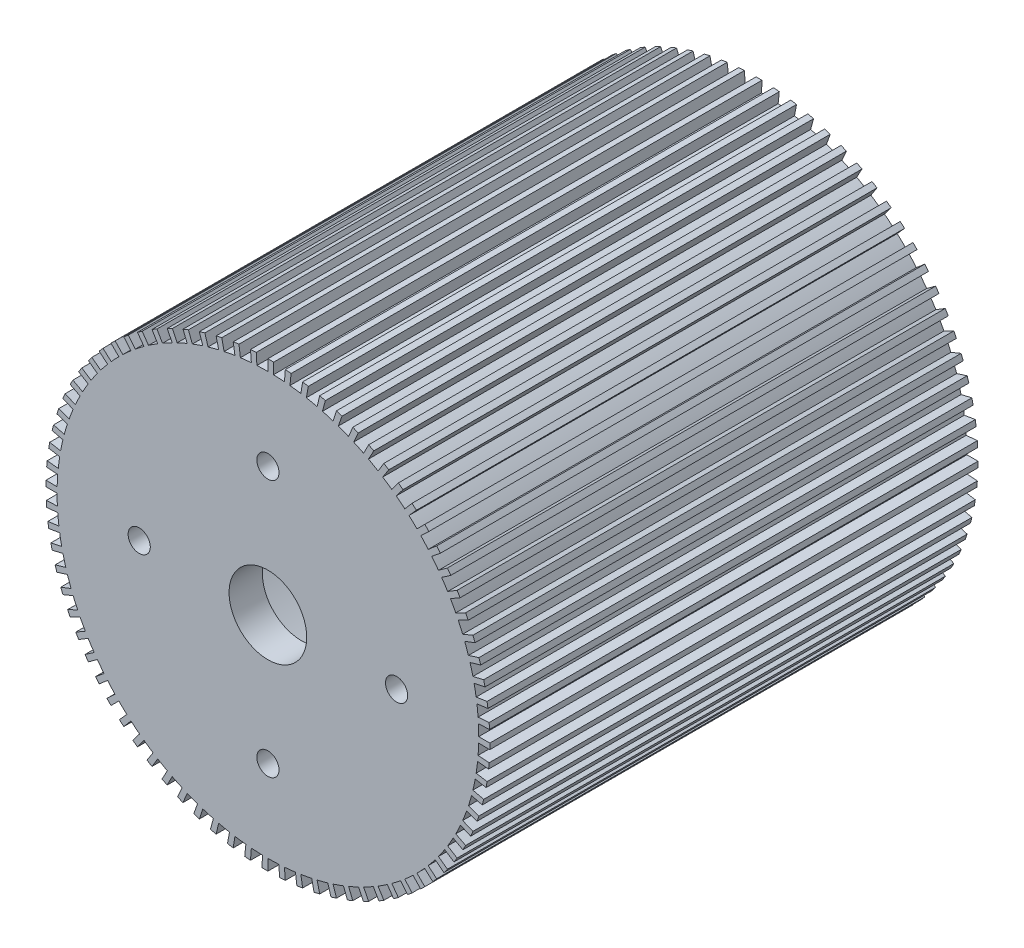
SolidWorks part; units mm, degrees
ref_plane "Alzado" through (0, 0, 0) normal (0, 0, 1) x (1, 0, 0)
ref_plane "Planta" through (0, 0, 0) normal (0, 1, 0) x (1, 0, 0)
ref_plane "Vista lateral" through (0, 0, 0) normal (1, 0, 0) x (0, 0, -1)
sketch "Croquis1" plane through (0, 0, 0) normal (0, 0, 1) x (1, 0, 0)
  circle A0 centre (0, 0) radius 100
  dimension "D1" = 200
extrude "Saliente-Extruir1" add sketch "Croquis1" along normal blind 220
sketch "Croquis3" plane through (0, 0, 0) normal (1, 0, 0) x (0, 0, -1)
  line L0 (0, 0) -> (23.7635, 0) construction
sketch "Croquis4" plane through (0, 0, 0) normal (0, 0, -1) x (-1, 0, 0)
  line L0 (0, 95) -> (0, 100)
  line L1 (4.9719, 94.8698) -> (5.2336, 99.863)
  line L2 (7.4536, 94.7071) -> (7.8459, 99.6917)
  line L3 (12.4, 94.1873) -> (13.0526, 99.1445)
  line L4 (14.8613, 93.8304) -> (15.6434, 98.7688)
  line L5 (19.7516, 92.924) -> (20.7912, 97.8148)
  line L6 (22.1773, 92.3751) -> (23.3445, 97.237)
  line L7 (26.9815, 91.0879) -> (28.4015, 95.882)
  line L8 (29.3566, 90.3504) -> (30.9017, 95.1057)
  line L9 (34.045, 88.6901) -> (35.8368, 93.358)
  line L10 (36.3549, 87.7686) -> (38.2683, 92.388)
  line L11 (40.8986, 85.7456) -> (43.0511, 90.2585)
  line L12 (43.1291, 84.6456) -> (45.399, 89.1007)
  line L13 (47.5, 82.2724) -> (50, 86.6025)
  line L14 (49.6374, 81.0008) -> (52.2499, 85.264)
  line L15 (53.8086, 78.292) -> (56.6406, 82.4126)
  line L16 (55.8396, 76.8566) -> (58.7785, 80.9017)
  line L17 (59.7854, 73.8289) -> (62.932, 77.7146)
  line L18 (61.6976, 72.2386) -> (64.9448, 76.0406)
  line L19 (65.3937, 68.9106) -> (68.8355, 72.5374)
  line L20 (67.1751, 67.1751) -> (70.7107, 70.7107)
  line L21 (70.5988, 63.5674) -> (74.3145, 66.9131)
  line L22 (72.2386, 61.6976) -> (76.0406, 64.9448)
  line L23 (75.3686, 57.8323) -> (79.3353, 60.8761)
  line L24 (76.8566, 55.8396) -> (80.9017, 58.7785)
  line L25 (79.6737, 51.7407) -> (83.8671, 54.4639)
  line L26 (81.0008, 49.6374) -> (85.264, 52.2499)
  line L27 (83.4876, 45.3301) -> (87.8817, 47.7159)
  line L28 (84.6456, 43.1291) -> (89.1007, 45.399)
  line L29 (86.7868, 38.64) -> (91.3545, 40.6737)
  line L30 (87.7686, 36.3549) -> (92.388, 38.2683)
  line L31 (89.5509, 31.7117) -> (94.2641, 33.3807)
  line L32 (90.3504, 29.3566) -> (95.1057, 30.9017)
  line L33 (91.763, 24.5878) -> (96.5926, 25.8819)
  line L34 (92.3751, 22.1773) -> (97.237, 23.3445)
  line L35 (93.4092, 17.3124) -> (98.3255, 18.2236)
  line L36 (93.8304, 14.8613) -> (98.7688, 15.6434)
  line L37 (94.4796, 9.9302) -> (99.4522, 10.4528)
  line L38 (94.7071, 7.4536) -> (99.6917, 7.8459)
  line L39 (94.9674, 2.4868) -> (99.9657, 2.6177)
  line L40 (95, 0) -> (100, 0)
  line L41 (94.8698, -4.9719) -> (99.863, -5.2336)
  line L42 (94.7071, -7.4536) -> (99.6917, -7.8459)
  line L43 (94.1873, -12.4) -> (99.1445, -13.0526)
  line L44 (93.8304, -14.8613) -> (98.7688, -15.6434)
  line L45 (92.924, -19.7516) -> (97.8148, -20.7912)
  line L46 (92.3751, -22.1773) -> (97.237, -23.3445)
  line L47 (91.0879, -26.9815) -> (95.882, -28.4015)
  line L48 (90.3504, -29.3566) -> (95.1057, -30.9017)
  line L49 (88.6901, -34.045) -> (93.358, -35.8368)
  line L50 (87.7686, -36.3549) -> (92.388, -38.2683)
  line L51 (85.7456, -40.8986) -> (90.2585, -43.0511)
  line L52 (84.6456, -43.1291) -> (89.1007, -45.399)
  line L53 (82.2724, -47.5) -> (86.6025, -50)
  line L54 (81.0008, -49.6374) -> (85.264, -52.2499)
  line L55 (78.292, -53.8086) -> (82.4126, -56.6406)
  line L56 (76.8566, -55.8396) -> (80.9017, -58.7785)
  line L57 (73.8289, -59.7854) -> (77.7146, -62.932)
  line L58 (72.2386, -61.6976) -> (76.0406, -64.9448)
  line L59 (68.9106, -65.3937) -> (72.5374, -68.8355)
  line L60 (67.1751, -67.1751) -> (70.7107, -70.7107)
  line L61 (63.5674, -70.5988) -> (66.9131, -74.3145)
  line L62 (61.6976, -72.2386) -> (64.9448, -76.0406)
  line L63 (57.8323, -75.3686) -> (60.8761, -79.3353)
  line L64 (55.8396, -76.8566) -> (58.7785, -80.9017)
  line L65 (51.7407, -79.6737) -> (54.4639, -83.8671)
  line L66 (49.6374, -81.0008) -> (52.2499, -85.264)
  line L67 (45.3301, -83.4876) -> (47.7159, -87.8817)
  line L68 (43.1291, -84.6456) -> (45.399, -89.1007)
  line L69 (38.64, -86.7868) -> (40.6737, -91.3545)
  line L70 (36.3549, -87.7686) -> (38.2683, -92.388)
  line L71 (31.7117, -89.5509) -> (33.3807, -94.2641)
  line L72 (29.3566, -90.3504) -> (30.9017, -95.1057)
  line L73 (24.5878, -91.763) -> (25.8819, -96.5926)
  line L74 (22.1773, -92.3751) -> (23.3445, -97.237)
  line L75 (17.3124, -93.4092) -> (18.2236, -98.3255)
  line L76 (14.8613, -93.8304) -> (15.6434, -98.7688)
  line L77 (9.9302, -94.4796) -> (10.4528, -99.4522)
  line L78 (7.4536, -94.7071) -> (7.8459, -99.6917)
  line L79 (2.4868, -94.9674) -> (2.6177, -99.9657)
  line L80 (0, -95) -> (0, -100)
  line L81 (-4.9719, -94.8698) -> (-5.2336, -99.863)
  line L82 (-7.4536, -94.7071) -> (-7.8459, -99.6917)
  line L83 (-12.4, -94.1873) -> (-13.0526, -99.1445)
  line L84 (-14.8613, -93.8304) -> (-15.6434, -98.7688)
  line L85 (-19.7516, -92.924) -> (-20.7912, -97.8148)
  line L86 (-22.1773, -92.3751) -> (-23.3445, -97.237)
  line L87 (-26.9815, -91.0879) -> (-28.4015, -95.882)
  line L88 (-29.3566, -90.3504) -> (-30.9017, -95.1057)
  line L89 (-34.045, -88.6901) -> (-35.8368, -93.358)
  line L90 (-36.3549, -87.7686) -> (-38.2683, -92.388)
  line L91 (-40.8986, -85.7456) -> (-43.0511, -90.2585)
  line L92 (-43.1291, -84.6456) -> (-45.399, -89.1007)
  line L93 (-47.5, -82.2724) -> (-50, -86.6025)
  line L94 (-49.6374, -81.0008) -> (-52.2499, -85.264)
  line L95 (-53.8086, -78.292) -> (-56.6406, -82.4126)
  line L96 (-55.8396, -76.8566) -> (-58.7785, -80.9017)
  line L97 (-59.7854, -73.8289) -> (-62.932, -77.7146)
  line L98 (-61.6976, -72.2386) -> (-64.9448, -76.0406)
  line L99 (-65.3937, -68.9106) -> (-68.8355, -72.5374)
  line L100 (-67.1751, -67.1751) -> (-70.7107, -70.7107)
  line L101 (-70.5988, -63.5674) -> (-74.3145, -66.9131)
  line L102 (-72.2386, -61.6976) -> (-76.0406, -64.9448)
  line L103 (-75.3686, -57.8323) -> (-79.3353, -60.8761)
  line L104 (-76.8566, -55.8396) -> (-80.9017, -58.7785)
  line L105 (-79.6737, -51.7407) -> (-83.8671, -54.4639)
  line L106 (-81.0008, -49.6374) -> (-85.264, -52.2499)
  line L107 (-83.4876, -45.3301) -> (-87.8817, -47.7159)
  line L108 (-84.6456, -43.1291) -> (-89.1007, -45.399)
  line L109 (-86.7868, -38.64) -> (-91.3545, -40.6737)
  line L110 (-87.7686, -36.3549) -> (-92.388, -38.2683)
  line L111 (-89.5509, -31.7117) -> (-94.2641, -33.3807)
  line L112 (-90.3504, -29.3566) -> (-95.1057, -30.9017)
  line L113 (-91.763, -24.5878) -> (-96.5926, -25.8819)
  line L114 (-92.3751, -22.1773) -> (-97.237, -23.3445)
  line L115 (-93.4092, -17.3124) -> (-98.3255, -18.2236)
  line L116 (-93.8304, -14.8613) -> (-98.7688, -15.6434)
  line L117 (-94.4796, -9.9302) -> (-99.4522, -10.4528)
  line L118 (-94.7071, -7.4536) -> (-99.6917, -7.8459)
  line L119 (-94.9674, -2.4868) -> (-99.9657, -2.6177)
  line L120 (-95, 0) -> (-100, 0)
  line L121 (-94.8698, 4.9719) -> (-99.863, 5.2336)
  line L122 (-94.7071, 7.4536) -> (-99.6917, 7.8459)
  line L123 (-94.1873, 12.4) -> (-99.1445, 13.0526)
  line L124 (-93.8304, 14.8613) -> (-98.7688, 15.6434)
  line L125 (-92.924, 19.7516) -> (-97.8148, 20.7912)
  line L126 (-92.3751, 22.1773) -> (-97.237, 23.3445)
  line L127 (-91.0879, 26.9815) -> (-95.882, 28.4015)
  line L128 (-90.3504, 29.3566) -> (-95.1057, 30.9017)
  line L129 (-88.6901, 34.045) -> (-93.358, 35.8368)
  line L130 (-87.7686, 36.3549) -> (-92.388, 38.2683)
  line L131 (-85.7456, 40.8986) -> (-90.2585, 43.0511)
  line L132 (-84.6456, 43.1291) -> (-89.1007, 45.399)
  line L133 (-82.2724, 47.5) -> (-86.6025, 50)
  line L134 (-81.0008, 49.6374) -> (-85.264, 52.2499)
  line L135 (-78.292, 53.8086) -> (-82.4126, 56.6406)
  line L136 (-76.8566, 55.8396) -> (-80.9017, 58.7785)
  line L137 (-73.8289, 59.7854) -> (-77.7146, 62.932)
  line L138 (-72.2386, 61.6976) -> (-76.0406, 64.9448)
  line L139 (-68.9106, 65.3937) -> (-72.5374, 68.8355)
  line L140 (-67.1751, 67.1751) -> (-70.7107, 70.7107)
  line L141 (-63.5674, 70.5988) -> (-66.9131, 74.3145)
  line L142 (-61.6976, 72.2386) -> (-64.9448, 76.0406)
  line L143 (-57.8323, 75.3686) -> (-60.8761, 79.3353)
  line L144 (-55.8396, 76.8566) -> (-58.7785, 80.9017)
  line L145 (-51.7407, 79.6737) -> (-54.4639, 83.8671)
  line L146 (-49.6374, 81.0008) -> (-52.2499, 85.264)
  line L147 (-45.3301, 83.4876) -> (-47.7159, 87.8817)
  line L148 (-43.1291, 84.6456) -> (-45.399, 89.1007)
  line L149 (-38.64, 86.7868) -> (-40.6737, 91.3545)
  line L150 (-36.3549, 87.7686) -> (-38.2683, 92.388)
  line L151 (-31.7117, 89.5509) -> (-33.3807, 94.2641)
  line L152 (-29.3566, 90.3504) -> (-30.9017, 95.1057)
  line L153 (-24.5878, 91.763) -> (-25.8819, 96.5926)
  line L154 (-22.1773, 92.3751) -> (-23.3445, 97.237)
  line L155 (-17.3124, 93.4092) -> (-18.2236, 98.3255)
  line L156 (-14.8613, 93.8304) -> (-15.6434, 98.7688)
  line L157 (-9.9302, 94.4796) -> (-10.4528, 99.4522)
  line L158 (-7.4536, 94.7071) -> (-7.8459, 99.6917)
  line L159 (-2.4868, 94.9674) -> (-2.6177, 99.9657)
  arc A0 (5.2336, 99.863) -> (0, 100) centre (0, 0) ccw
  arc A1 (4.9719, 94.8698) -> (0, 95) centre (0, 0) ccw
  arc A2 (12.4, 94.1873) -> (7.4536, 94.7071) centre (0, 0) ccw
  arc A3 (13.0526, 99.1445) -> (7.8459, 99.6917) centre (0, 0) ccw
  arc A4 (19.7516, 92.924) -> (14.8613, 93.8304) centre (0, 0) ccw
  arc A5 (20.7912, 97.8148) -> (15.6434, 98.7688) centre (0, 0) ccw
  arc A6 (26.9815, 91.0879) -> (22.1773, 92.3751) centre (0, 0) ccw
  arc A7 (28.4015, 95.882) -> (23.3445, 97.237) centre (0, 0) ccw
  arc A8 (34.045, 88.6901) -> (29.3566, 90.3504) centre (0, 0) ccw
  arc A9 (35.8368, 93.358) -> (30.9017, 95.1057) centre (0, 0) ccw
  arc A10 (40.8986, 85.7456) -> (36.3549, 87.7686) centre (0, 0) ccw
  arc A11 (43.0511, 90.2585) -> (38.2683, 92.388) centre (0, 0) ccw
  arc A12 (47.5, 82.2724) -> (43.1291, 84.6456) centre (0, 0) ccw
  arc A13 (50, 86.6025) -> (45.399, 89.1007) centre (0, 0) ccw
  arc A14 (53.8086, 78.292) -> (49.6374, 81.0008) centre (0, 0) ccw
  arc A15 (56.6406, 82.4126) -> (52.2499, 85.264) centre (0, 0) ccw
  arc A16 (59.7854, 73.8289) -> (55.8396, 76.8566) centre (0, 0) ccw
  arc A17 (62.932, 77.7146) -> (58.7785, 80.9017) centre (0, 0) ccw
  arc A18 (65.3937, 68.9106) -> (61.6976, 72.2386) centre (0, 0) ccw
  arc A19 (68.8355, 72.5374) -> (64.9448, 76.0406) centre (0, 0) ccw
  arc A20 (70.5988, 63.5674) -> (67.1751, 67.1751) centre (0, 0) ccw
  arc A21 (74.3145, 66.9131) -> (70.7107, 70.7107) centre (0, 0) ccw
  arc A22 (75.3686, 57.8323) -> (72.2386, 61.6976) centre (0, 0) ccw
  arc A23 (79.3353, 60.8761) -> (76.0406, 64.9448) centre (0, 0) ccw
  arc A24 (79.6737, 51.7407) -> (76.8566, 55.8396) centre (0, 0) ccw
  arc A25 (83.8671, 54.4639) -> (80.9017, 58.7785) centre (0, 0) ccw
  arc A26 (83.4876, 45.3301) -> (81.0008, 49.6374) centre (0, 0) ccw
  arc A27 (87.8817, 47.7159) -> (85.264, 52.2499) centre (0, 0) ccw
  arc A28 (86.7868, 38.64) -> (84.6456, 43.1291) centre (0, 0) ccw
  arc A29 (91.3545, 40.6737) -> (89.1007, 45.399) centre (0, 0) ccw
  arc A30 (89.5509, 31.7117) -> (87.7686, 36.3549) centre (0, 0) ccw
  arc A31 (94.2641, 33.3807) -> (92.388, 38.2683) centre (0, 0) ccw
  arc A32 (91.763, 24.5878) -> (90.3504, 29.3566) centre (0, 0) ccw
  arc A33 (96.5926, 25.8819) -> (95.1057, 30.9017) centre (0, 0) ccw
  arc A34 (93.4092, 17.3124) -> (92.3751, 22.1773) centre (0, 0) ccw
  arc A35 (98.3255, 18.2236) -> (97.237, 23.3445) centre (0, 0) ccw
  arc A36 (94.4796, 9.9302) -> (93.8304, 14.8613) centre (0, 0) ccw
  arc A37 (99.4522, 10.4528) -> (98.7688, 15.6434) centre (0, 0) ccw
  arc A38 (94.9674, 2.4868) -> (94.7071, 7.4536) centre (0, 0) ccw
  arc A39 (99.9657, 2.6177) -> (99.6917, 7.8459) centre (0, 0) ccw
  arc A40 (94.8698, -4.9719) -> (95, 0) centre (0, 0) ccw
  arc A41 (99.863, -5.2336) -> (100, 0) centre (0, 0) ccw
  arc A42 (94.1873, -12.4) -> (94.7071, -7.4536) centre (0, 0) ccw
  arc A43 (99.1445, -13.0526) -> (99.6917, -7.8459) centre (0, 0) ccw
  arc A44 (92.924, -19.7516) -> (93.8304, -14.8613) centre (0, 0) ccw
  arc A45 (97.8148, -20.7912) -> (98.7688, -15.6434) centre (0, 0) ccw
  arc A46 (91.0879, -26.9815) -> (92.3751, -22.1773) centre (0, 0) ccw
  arc A47 (95.882, -28.4015) -> (97.237, -23.3445) centre (0, 0) ccw
  arc A48 (88.6901, -34.045) -> (90.3504, -29.3566) centre (0, 0) ccw
  arc A49 (93.358, -35.8368) -> (95.1057, -30.9017) centre (0, 0) ccw
  arc A50 (85.7456, -40.8986) -> (87.7686, -36.3549) centre (0, 0) ccw
  arc A51 (90.2585, -43.0511) -> (92.388, -38.2683) centre (0, 0) ccw
  arc A52 (82.2724, -47.5) -> (84.6456, -43.1291) centre (0, 0) ccw
  arc A53 (86.6025, -50) -> (89.1007, -45.399) centre (0, 0) ccw
  arc A54 (78.292, -53.8086) -> (81.0008, -49.6374) centre (0, 0) ccw
  arc A55 (82.4126, -56.6406) -> (85.264, -52.2499) centre (0, 0) ccw
  arc A56 (73.8289, -59.7854) -> (76.8566, -55.8396) centre (0, 0) ccw
  arc A57 (77.7146, -62.932) -> (80.9017, -58.7785) centre (0, 0) ccw
  arc A58 (68.9106, -65.3937) -> (72.2386, -61.6976) centre (0, 0) ccw
  arc A59 (72.5374, -68.8355) -> (76.0406, -64.9448) centre (0, 0) ccw
  arc A60 (63.5674, -70.5988) -> (67.1751, -67.1751) centre (0, 0) ccw
  arc A61 (66.9131, -74.3145) -> (70.7107, -70.7107) centre (0, 0) ccw
  arc A62 (57.8323, -75.3686) -> (61.6976, -72.2386) centre (0, 0) ccw
  arc A63 (60.8761, -79.3353) -> (64.9448, -76.0406) centre (0, 0) ccw
  arc A64 (51.7407, -79.6737) -> (55.8396, -76.8566) centre (0, 0) ccw
  arc A65 (54.4639, -83.8671) -> (58.7785, -80.9017) centre (0, 0) ccw
  arc A66 (45.3301, -83.4876) -> (49.6374, -81.0008) centre (0, 0) ccw
  arc A67 (47.7159, -87.8817) -> (52.2499, -85.264) centre (0, 0) ccw
  arc A68 (38.64, -86.7868) -> (43.1291, -84.6456) centre (0, 0) ccw
  arc A69 (40.6737, -91.3545) -> (45.399, -89.1007) centre (0, 0) ccw
  arc A70 (31.7117, -89.5509) -> (36.3549, -87.7686) centre (0, 0) ccw
  arc A71 (33.3807, -94.2641) -> (38.2683, -92.388) centre (0, 0) ccw
  arc A72 (24.5878, -91.763) -> (29.3566, -90.3504) centre (0, 0) ccw
  arc A73 (25.8819, -96.5926) -> (30.9017, -95.1057) centre (0, 0) ccw
  arc A74 (17.3124, -93.4092) -> (22.1773, -92.3751) centre (0, 0) ccw
  arc A75 (18.2236, -98.3255) -> (23.3445, -97.237) centre (0, 0) ccw
  arc A76 (9.9302, -94.4796) -> (14.8613, -93.8304) centre (0, 0) ccw
  arc A77 (10.4528, -99.4522) -> (15.6434, -98.7688) centre (0, 0) ccw
  arc A78 (2.4868, -94.9674) -> (7.4536, -94.7071) centre (0, 0) ccw
  arc A79 (2.6177, -99.9657) -> (7.8459, -99.6917) centre (0, 0) ccw
  arc A80 (-4.9719, -94.8698) -> (0, -95) centre (0, 0) ccw
  arc A81 (-5.2336, -99.863) -> (0, -100) centre (0, 0) ccw
  arc A82 (-12.4, -94.1873) -> (-7.4536, -94.7071) centre (0, 0) ccw
  arc A83 (-13.0526, -99.1445) -> (-7.8459, -99.6917) centre (0, 0) ccw
  arc A84 (-19.7516, -92.924) -> (-14.8613, -93.8304) centre (0, 0) ccw
  arc A85 (-20.7912, -97.8148) -> (-15.6434, -98.7688) centre (0, 0) ccw
  arc A86 (-26.9815, -91.0879) -> (-22.1773, -92.3751) centre (0, 0) ccw
  arc A87 (-28.4015, -95.882) -> (-23.3445, -97.237) centre (0, 0) ccw
  arc A88 (-34.045, -88.6901) -> (-29.3566, -90.3504) centre (0, 0) ccw
  arc A89 (-35.8368, -93.358) -> (-30.9017, -95.1057) centre (0, 0) ccw
  arc A90 (-40.8986, -85.7456) -> (-36.3549, -87.7686) centre (0, 0) ccw
  arc A91 (-43.0511, -90.2585) -> (-38.2683, -92.388) centre (0, 0) ccw
  arc A92 (-47.5, -82.2724) -> (-43.1291, -84.6456) centre (0, 0) ccw
  arc A93 (-50, -86.6025) -> (-45.399, -89.1007) centre (0, 0) ccw
  arc A94 (-53.8086, -78.292) -> (-49.6374, -81.0008) centre (0, 0) ccw
  arc A95 (-56.6406, -82.4126) -> (-52.2499, -85.264) centre (0, 0) ccw
  arc A96 (-59.7854, -73.8289) -> (-55.8396, -76.8566) centre (0, 0) ccw
  arc A97 (-62.932, -77.7146) -> (-58.7785, -80.9017) centre (0, 0) ccw
  arc A98 (-65.3937, -68.9106) -> (-61.6976, -72.2386) centre (0, 0) ccw
  arc A99 (-68.8355, -72.5374) -> (-64.9448, -76.0406) centre (0, 0) ccw
  arc A100 (-70.5988, -63.5674) -> (-67.1751, -67.1751) centre (0, 0) ccw
  arc A101 (-74.3145, -66.9131) -> (-70.7107, -70.7107) centre (0, 0) ccw
  arc A102 (-75.3686, -57.8323) -> (-72.2386, -61.6976) centre (0, 0) ccw
  arc A103 (-79.3353, -60.8761) -> (-76.0406, -64.9448) centre (0, 0) ccw
  arc A104 (-79.6737, -51.7407) -> (-76.8566, -55.8396) centre (0, 0) ccw
  arc A105 (-83.8671, -54.4639) -> (-80.9017, -58.7785) centre (0, 0) ccw
  arc A106 (-83.4876, -45.3301) -> (-81.0008, -49.6374) centre (0, 0) ccw
  arc A107 (-87.8817, -47.7159) -> (-85.264, -52.2499) centre (0, 0) ccw
  arc A108 (-86.7868, -38.64) -> (-84.6456, -43.1291) centre (0, 0) ccw
  arc A109 (-91.3545, -40.6737) -> (-89.1007, -45.399) centre (0, 0) ccw
  arc A110 (-89.5509, -31.7117) -> (-87.7686, -36.3549) centre (0, 0) ccw
  arc A111 (-94.2641, -33.3807) -> (-92.388, -38.2683) centre (0, 0) ccw
  arc A112 (-91.763, -24.5878) -> (-90.3504, -29.3566) centre (0, 0) ccw
  arc A113 (-96.5926, -25.8819) -> (-95.1057, -30.9017) centre (0, 0) ccw
  arc A114 (-93.4092, -17.3124) -> (-92.3751, -22.1773) centre (0, 0) ccw
  arc A115 (-98.3255, -18.2236) -> (-97.237, -23.3445) centre (0, 0) ccw
  arc A116 (-94.4796, -9.9302) -> (-93.8304, -14.8613) centre (0, 0) ccw
  arc A117 (-99.4522, -10.4528) -> (-98.7688, -15.6434) centre (0, 0) ccw
  arc A118 (-94.9674, -2.4868) -> (-94.7071, -7.4536) centre (0, 0) ccw
  arc A119 (-99.9657, -2.6177) -> (-99.6917, -7.8459) centre (0, 0) ccw
  arc A120 (-94.8698, 4.9719) -> (-95, 0) centre (0, 0) ccw
  arc A121 (-99.863, 5.2336) -> (-100, 0) centre (0, 0) ccw
  arc A122 (-94.1873, 12.4) -> (-94.7071, 7.4536) centre (0, 0) ccw
  arc A123 (-99.1445, 13.0526) -> (-99.6917, 7.8459) centre (0, 0) ccw
  arc A124 (-92.924, 19.7516) -> (-93.8304, 14.8613) centre (0, 0) ccw
  arc A125 (-97.8148, 20.7912) -> (-98.7688, 15.6434) centre (0, 0) ccw
  arc A126 (-91.0879, 26.9815) -> (-92.3751, 22.1773) centre (0, 0) ccw
  arc A127 (-95.882, 28.4015) -> (-97.237, 23.3445) centre (0, 0) ccw
  arc A128 (-88.6901, 34.045) -> (-90.3504, 29.3566) centre (0, 0) ccw
  arc A129 (-93.358, 35.8368) -> (-95.1057, 30.9017) centre (0, 0) ccw
  arc A130 (-85.7456, 40.8986) -> (-87.7686, 36.3549) centre (0, 0) ccw
  arc A131 (-90.2585, 43.0511) -> (-92.388, 38.2683) centre (0, 0) ccw
  arc A132 (-82.2724, 47.5) -> (-84.6456, 43.1291) centre (0, 0) ccw
  arc A133 (-86.6025, 50) -> (-89.1007, 45.399) centre (0, 0) ccw
  arc A134 (-78.292, 53.8086) -> (-81.0008, 49.6374) centre (0, 0) ccw
  arc A135 (-82.4126, 56.6406) -> (-85.264, 52.2499) centre (0, 0) ccw
  arc A136 (-73.8289, 59.7854) -> (-76.8566, 55.8396) centre (0, 0) ccw
  arc A137 (-77.7146, 62.932) -> (-80.9017, 58.7785) centre (0, 0) ccw
  arc A138 (-68.9106, 65.3937) -> (-72.2386, 61.6976) centre (0, 0) ccw
  arc A139 (-72.5374, 68.8355) -> (-76.0406, 64.9448) centre (0, 0) ccw
  arc A140 (-63.5674, 70.5988) -> (-67.1751, 67.1751) centre (0, 0) ccw
  arc A141 (-66.9131, 74.3145) -> (-70.7107, 70.7107) centre (0, 0) ccw
  arc A142 (-57.8323, 75.3686) -> (-61.6976, 72.2386) centre (0, 0) ccw
  arc A143 (-60.8761, 79.3353) -> (-64.9448, 76.0406) centre (0, 0) ccw
  arc A144 (-51.7407, 79.6737) -> (-55.8396, 76.8566) centre (0, 0) ccw
  arc A145 (-54.4639, 83.8671) -> (-58.7785, 80.9017) centre (0, 0) ccw
  arc A146 (-45.3301, 83.4876) -> (-49.6374, 81.0008) centre (0, 0) ccw
  arc A147 (-47.7159, 87.8817) -> (-52.2499, 85.264) centre (0, 0) ccw
  arc A148 (-38.64, 86.7868) -> (-43.1291, 84.6456) centre (0, 0) ccw
  arc A149 (-40.6737, 91.3545) -> (-45.399, 89.1007) centre (0, 0) ccw
  arc A150 (-31.7117, 89.5509) -> (-36.3549, 87.7686) centre (0, 0) ccw
  arc A151 (-33.3807, 94.2641) -> (-38.2683, 92.388) centre (0, 0) ccw
  arc A152 (-24.5878, 91.763) -> (-29.3566, 90.3504) centre (0, 0) ccw
  arc A153 (-25.8819, 96.5926) -> (-30.9017, 95.1057) centre (0, 0) ccw
  arc A154 (-17.3124, 93.4092) -> (-22.1773, 92.3751) centre (0, 0) ccw
  arc A155 (-18.2236, 98.3255) -> (-23.3445, 97.237) centre (0, 0) ccw
  arc A156 (-9.9302, 94.4796) -> (-14.8613, 93.8304) centre (0, 0) ccw
  arc A157 (-10.4528, 99.4522) -> (-15.6434, 98.7688) centre (0, 0) ccw
  arc A158 (-2.4868, 94.9674) -> (-7.4536, 94.7071) centre (0, 0) ccw
  arc A159 (-2.6177, 99.9657) -> (-7.8459, 99.6917) centre (0, 0) ccw
  dimension "D1" = 190
  dimension "D2" = 200
  dimension "D3" = 2
  dimension "D4" = 80
extrude "Cortar-Extruir2" cut sketch "Croquis4" against normal blind 220
sketch "Croquis5" plane through (0, 0, 0) normal (0, 0, -1) x (-1, 0, 0)
  circle A0 centre (0, 0) radius 90
  dimension "D1" = 180
extrude "Cortar-Extruir3" cut sketch "Croquis5" against normal blind 205
sketch "Croquis6" plane through (0, 0, 220) normal (0, 0, 1) x (1, 0, 0)
  circle A0 centre (0, 0) radius 17.5
  dimension "D1" = 35
extrude "Cortar-Extruir4" cut sketch "Croquis6" against normal up to next
sketch "Croquis7" plane through (0, 0, 220) normal (0, 0, 1) x (1, 0, 0)
  circle A0 centre (0, 58) radius 5
  circle A1 centre (58, 0) radius 5
  circle A2 centre (0, -58) radius 5
  circle A3 centre (-58, 0) radius 5
  dimension "D2" = 10
  dimension "D1" = 58
  dimension "D3" = 4
extrude "Cortar-Extruir5" cut sketch "Croquis7" against normal up to next
